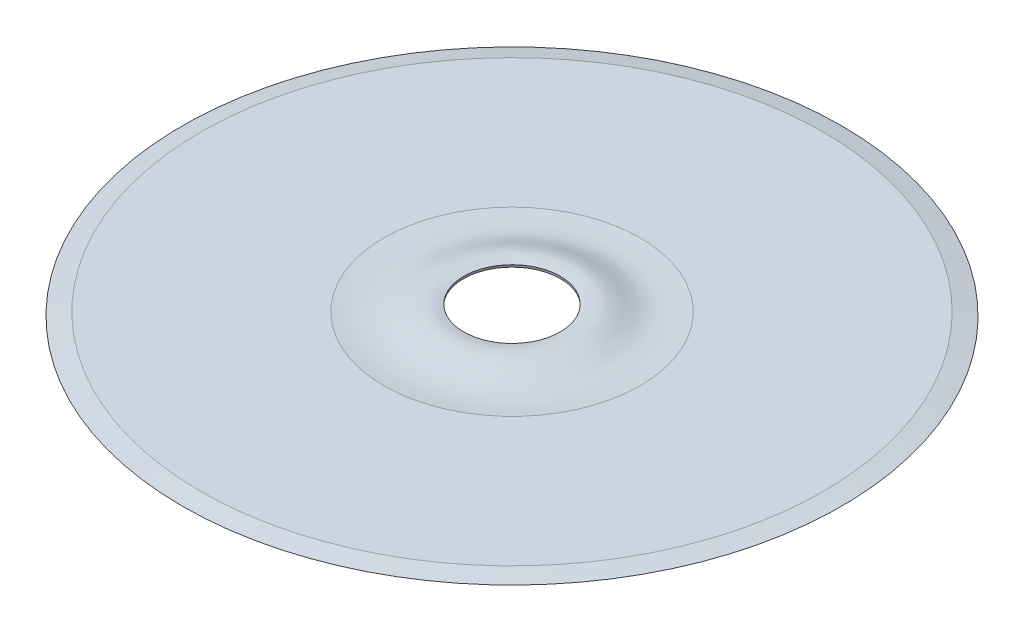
SolidWorks part; units mm, degrees
ref_plane "Plan1" through (0, 0, 0) normal (0, 0, 1) x (1, 0, 0)
ref_plane "Plan2" through (0, 0, 0) normal (0, 1, 0) x (1, 0, 0)
ref_plane "Plan3" through (0, 0, 0) normal (1, 0, 0) x (0, 0, -1)
sketch "Esquisse1" plane through (0, 0, 0) normal (0, 0, 1) x (1, 0, 0)
  line L0 (0, 70) -> (0, -80) construction
  line L1 (70, 0) -> (170, 0)
  line L2 (50, -2) -> (180, -2)
  line L3 (50, -2) -> (35.2151, 3.6346)
  line L4 (35.2151, 3.6346) -> (26.4935, 2.3774)
  line L5 (170, 0) -> (180, -2)
  arc A0 (26.4935, 2.3774) -> (26.3505, 3.6346) centre (0, 0) ccw
  point P6 (33.1726, 4.5755)
  point P7 (50, 0)
  dimension "D1" = 53.2
  dimension "D2" = 100
  dimension "D3" = 2
revolve "Base-Révolution" add sketch "Esquisse1" angle 360 about L0
